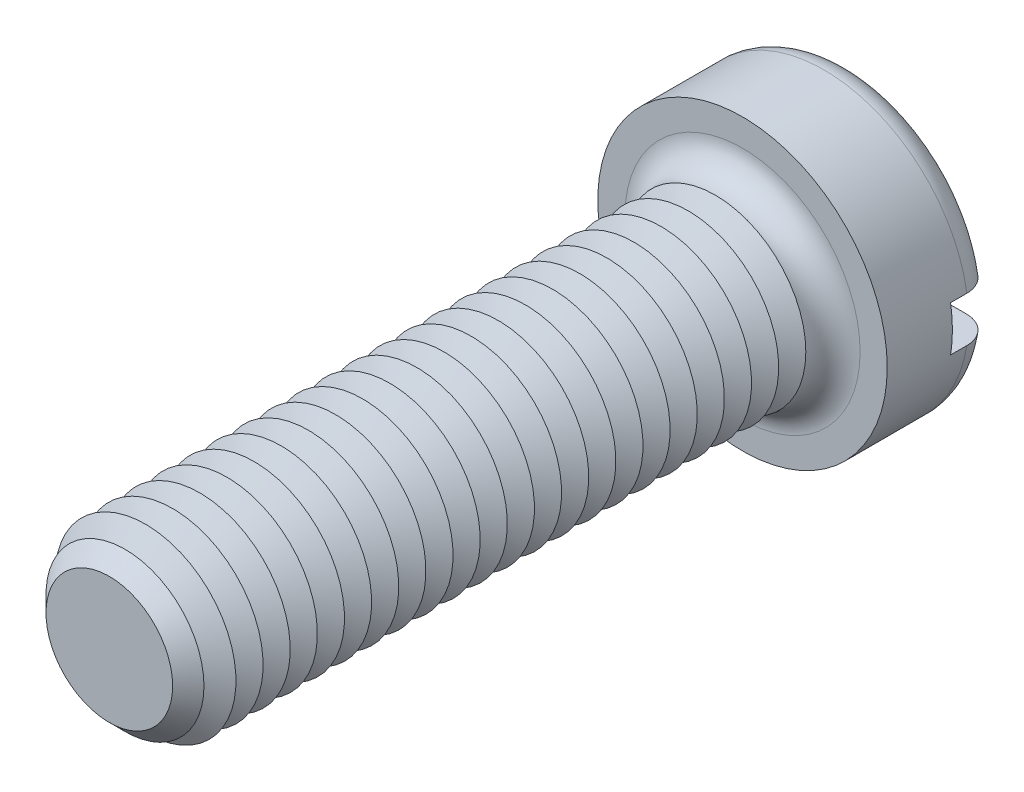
SolidWorks part; units mm, degrees
ref_plane "Front Plane" through (0, 0, 0) normal (0, 0, 1) x (1, 0, 0)
ref_plane "Top Plane" through (0, 0, 0) normal (0, 1, 0) x (1, 0, 0)
ref_plane "Right Plane" through (0, 0, 0) normal (1, 0, 0) x (0, 0, -1)
sketch "Sketch3" plane through (0, 0, 0) normal (0, 0, 1) x (1, 0, 0)
  circle A0 centre (0, 0) radius 8
  dimension "D1" = 16
extrude "Boss-Extrude2" add sketch "Sketch3" against normal blind 6
sketch "Sketch4" plane through (0, 0, 0) normal (0, 0, 1) x (1, 0, 0)
  circle A0 centre (0, 0) radius 5
  dimension "D1" = 10
extrude "Boss-Extrude3" add sketch "Sketch4" along normal blind 35
fillet "Fillet1" radius 1.5 2 edges at (8, 0, -6) (5, 0, 0)
chamfer "Chamfer1" distance 1.5 angle 45 1 edges at (5, 0, 35)
sketch "Sketch5" plane through (0, 0, 0) normal (1, 0, 0) x (0, 0, -1)
  line L0 (1.6944, 0) -> (-7.6738, 0) construction
sketch "Sketch6" plane through (0, 0, 0) normal (1, 0, 0) x (0, 0, -1)
  line L0 (-1.5, 5) -> (-2.25, 3.701)
  line L1 (-2.25, 3.701) -> (-3, 5)
  line L2 (-1.5, 5) -> (-33.5, 5) construction
  line L3 (-3, 5) -> (-1.5, 5)
  dimension "D1" = 1.5
revolve "Cut-Revolve1" cut sketch "Sketch6" angle 360 about L0
pattern_linear "LPattern1" count 22 spacing 1.5 along (0, 0, 1) of "Cut-Revolve1"
sketch "Sketch8" plane through (0, 0, -6) normal (0, 0, -1) x (-1, 0, 0)
  line L1 (8, -1.25) -> (-8, -1.25)
  line L2 (8, -1.25) -> (8, 1.25)
  line L3 (8, 1.25) -> (-8, 1.25)
  line L4 (-8, -1.25) -> (-8, 1.25)
  line L5 (8, -1.25) -> (-8, 1.25) construction
  line L6 (8, 1.25) -> (-8, -1.25) construction
  point P0 (0, 0)
  dimension "D1" = 16
  dimension "D2" = 2.5
extrude "Cut-Extrude1" cut sketch "Sketch8" against normal blind 2.4
